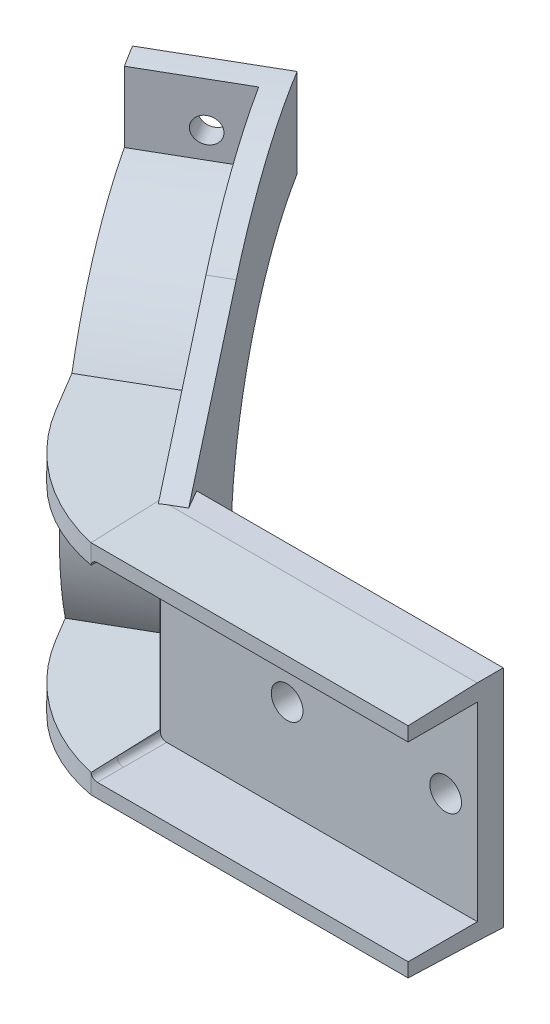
SolidWorks part; units mm, degrees
ref_plane "Plan1" through (0, 0, 0) normal (0, 0, 1) x (1, 0, 0)
ref_plane "Plan2" through (0, 0, 0) normal (0, 1, 0) x (1, 0, 0)
ref_plane "Plan3" through (0, 0, 0) normal (1, 0, 0) x (0, 0, -1)
ref_plane "Plan6" through (-660, 0, 0) normal (1, 0, 0) x (0, 0, -1)
ref_plane "Plan8" through (-485.9067, 0, 280.5384) normal (-0.866, 0, 0.5) x (0.5, 0, 0.866)
ref_plane "Plan9" through (-487.2058, 0, 281.2884) normal (-0.866, 0, 0.5) x (0.5, 0, 0.866)
sketch "Esquisse3" plane through (-487.2058, 0, 281.2884) normal (-0.866, 0, 0.5) x (0.5, 0, 0.866)
  line L0 (-228, 0) -> (-551, 0) construction
  line L1 (-392.6132, 0) -> (-64.988, 0) construction
  line L2 (-348, 17.3805) -> (-348, -17.3805)
  line L3 (-348, 17.3805) -> (-368.783, 34.8195)
  line L5 (-395, 45.3545) -> (-395, 30.8545)
  line L6 (-348, -17.3805) -> (-368.783, -34.8195)
  line L7 (-395, -45.3545) -> (-395, -30.8545)
  line L11 (-330, 13) -> (-330, -13) construction
  arc A0 (-395, -30.8545) -> (-395, 30.8545) centre (-398, 0) ccw
  arc A1 (-368.783, 34.8195) -> (-395, 45.3545) centre (-398, 0) ccw
  arc A2 (-395, -45.3545) -> (-368.783, -34.8195) centre (-398, 0) ccw
  point P13 (-348.1865, 0)
  dimension "D1" = 14.5
  dimension "D3" = 31
  dimension "D2" = 3
  dimension "D4" = 47
  dimension "D5" = 40
  dimension "D6" = 40
  dimension "D7" = 65
extrude "Base-Extrusion" add sketch "Esquisse3" against normal blind 3.5
sketch "Esquisse4" plane through (-487.2058, 0, 281.2884) normal (-0.866, 0, 0.5) x (0.5, 0, 0.866)
  line L0 (-391.5, 33.8821) -> (-391.5, 44.9864)
  line L1 (-395, 45.3545) -> (-395, 30.8545) construction
  line L2 (-395, 30.8545) -> (-395, 45.3545)
  line L3 (-395, -30.8545) -> (-395, -45.3545) construction
  line L4 (-395, -30.8545) -> (-395, -45.3545)
  line L5 (-358, 0) -> (-472, 0) construction
  line L6 (-392.6132, 0) -> (-64.988, 0) construction
  line L7 (-391.5, -33.8821) -> (-391.5, -44.9864)
  line L8 (-366.043, -13) -> (-328.8796, -14.6226)
  line L9 (-328.8796, -16.7536) -> (-328.8796, -14.6226)
  line L10 (-368.8796, 18.5) -> (-328.8796, 16.7536)
  line L11 (-366.043, 13) -> (-328.8796, 14.6226)
  line L12 (-328.8796, 16.7536) -> (-328.8796, 14.6226)
  line L13 (-368.8796, -18.5) -> (-328.8796, -16.7536)
  arc A0 (-391.5, -33.8821) -> (-368.8796, -18.5) centre (-398, 0) ccw
  arc A1 (-368.783, 34.8195) -> (-395, 45.3545) centre (-398, 0) ccw construction
  arc A2 (-391.5, 44.9864) -> (-395, 45.3545) centre (-398, 0) ccw
  arc A3 (-395, -30.8545) -> (-395, 30.8545) centre (-398, 0) ccw construction
  arc A4 (-395, -30.8545) -> (-395, 30.8545) centre (-398, 0) ccw
  arc A5 (-391.5, -44.9864) -> (-395, -45.3545) centre (-398, 0) cw
  arc A6 (-368.8796, 18.5) -> (-391.5, 33.8821) centre (-398, 0) ccw
  arc A7 (-366.043, -13) -> (-366.043, 13) centre (-398, 0) ccw
  dimension "D1" = 69
  dimension "D2" = 3.5
  dimension "D3" = 18.5
  dimension "D4" = 13
  dimension "D5" = 40
  dimension "D6" = 2.5
  dimension "D7" = 2.5
extrude "Boss.-Extru.1" add sketch "Esquisse4" along normal blind 15.5
sketch "Esquisse5" plane through (-500.6292, 0, 289.0384) normal (-0.866, 0, 0.5) x (0.5, 0, 0.866)
  circle A1 centre (-398, 0) radius 31
  arc A2 (-395, -30.8545) -> (-395, 30.8545) centre (-398, 0) ccw construction
extrude "Enlèv. mat.-Extru.4" cut sketch "Esquisse5" against normal through all draft 1.5
sketch "Esquisse11" plane through (0, 0, 0) normal (0, 1, 0) x (1, 0, 0)
  line L0 (-661.7106, 20.9628) -> (-655.1846, 9.6596)
  line L1 (-511.3021, -239.5523) -> (-463.1094, -323.0245) construction
  line L4 (-648.7228, 9.5) -> (-609.2396, 9.5) construction
  line L6 (-698.1292, 53.0417) -> (-681.6292, 24.4628)
  line L8 (-660, 21) -> (0, 21) construction
  line L10 (-681.6747, 62.5417) -> (-698.1292, 53.0417) construction
  line L11 (-661.7106, 20.9628) -> (-661.7106, 10.0817)
  arc A0 (-661.7106, 10.0817) -> (-681.6292, 24.4628) centre (-655.6484, 39.4628) cw
  dimension "D4" = 33
  dimension "D2" = 30
  dimension "D1" = 150
  dimension "D3" = 11.5
extrude "Enlèv. mat.-Extru.6" cut sketch "Esquisse11" against normal through all and the other way through all flip side to cut
sketch "Esquisse14" plane through (-661.7106, 0, 0) normal (1, 0, 0) x (0, 0, -1)
  line L1 (10.0817, -14.1551) -> (10.0817, -17.221) construction
  line L2 (10.0817, 17.221) -> (10.0817, 14.1551) construction
  line L5 (10.0817, 17.221) -> (20.9628, 17.6325) construction
  line L7 (0, 0) -> (46, 0) construction
  line L12 (20.9628, -17.6325) -> (10.0817, -17.221) construction
  line L13 (10.0817, -15) -> (10.0817, -17.221)
  line L14 (10.0817, 17.221) -> (10.0817, 15)
  line L15 (10.0817, 15) -> (21, 15)
  line L16 (10.0817, 17.221) -> (20.9628, 17.6325)
  line L17 (21, 15) -> (21, -15)
  line L18 (20.9628, -17.6325) -> (10.0817, -17.221)
  line L19 (25.0817, 17.6325) -> (25.0817, -17.8401)
  line L20 (38.1707, -18.5) -> (20.9628, -17.6325) construction
  line L21 (20.9628, -17.6325) -> (25.0817, -17.8401)
  line L22 (25.0817, 17.6325) -> (20.9628, 17.6325)
  line L23 (21, -15) -> (10.0817, -15)
  dimension "D1" = 15
extrude "Boss.-Extru.2" add sketch "Esquisse14" along normal blind 50
sketch "Esquisse15" plane through (0, 0, -21) normal (0, 0, 1) x (1, 0, 0)
  line L1 (-611.7106, 15) -> (-661.7106, 15)
  line L2 (-611.7106, 15) -> (-611.7106, -15)
  line L3 (-611.7106, -15) -> (-661.7106, -15)
  line L4 (-661.7106, 15) -> (-661.7106, -15)
extrude "Enlèv. mat.-Extru.8" cut sketch "Esquisse15" along normal blind 47.5
fillet "Congé1" radius 1
sketch "Esquisse18" plane through (-197.5, 0, -342.08) normal (-0.5, 0, -0.866) x (-0.866, 0, 0.5)
  line L0 (509.9314, 0) -> (589.6724, 0) construction
  line L1 (562.5768, 0) -> (578.0768, 0) construction
  line L2 (559.0768, 45.3545) -> (559.0768, 31.3543) construction
  line L3 (559.0768, 45.3545) -> (559.0768, 34.8195) construction
  circle A0 centre (568.5768, 38) radius 2
  circle A1 centre (568.5768, -38) radius 2
  dimension "D1" = 4
  dimension "D2" = 76
  dimension "D3" = 9.5
extrude "Enlèv. mat.-Extru.9" cut sketch "Esquisse18" against normal blind 47.5
sketch "Esquisse19" plane through (0, 0, -21) normal (0, 0, 1) x (1, 0, 0)
  line L0 (-611.7106, 0) -> (-652, 0) construction
  line L1 (-611.7106, 15) -> (-611.7106, -15) construction
  circle A0 centre (-616.7106, 0) radius 2.5
  circle A1 centre (-641.7106, 0) radius 2.5
  dimension "D3" = 5
  dimension "D1" = 5
  dimension "D2" = 25
extrude "Enlèv. mat.-Extru.10" cut sketch "Esquisse19" against normal blind 47.5
sketch "Esquisse24" plane through (-182.5, 0, -316.0993) normal (-0.5, 0, -0.866) x (-0.866, 0, 0.5)
  circle A0 centre (563.5768, 0) radius 1.5 construction
  circle A1 centre (563.5768, 0) radius 1.5
extrude "Enlèv. mat.-Extru.11" cut sketch "Esquisse24" along normal blind 10
